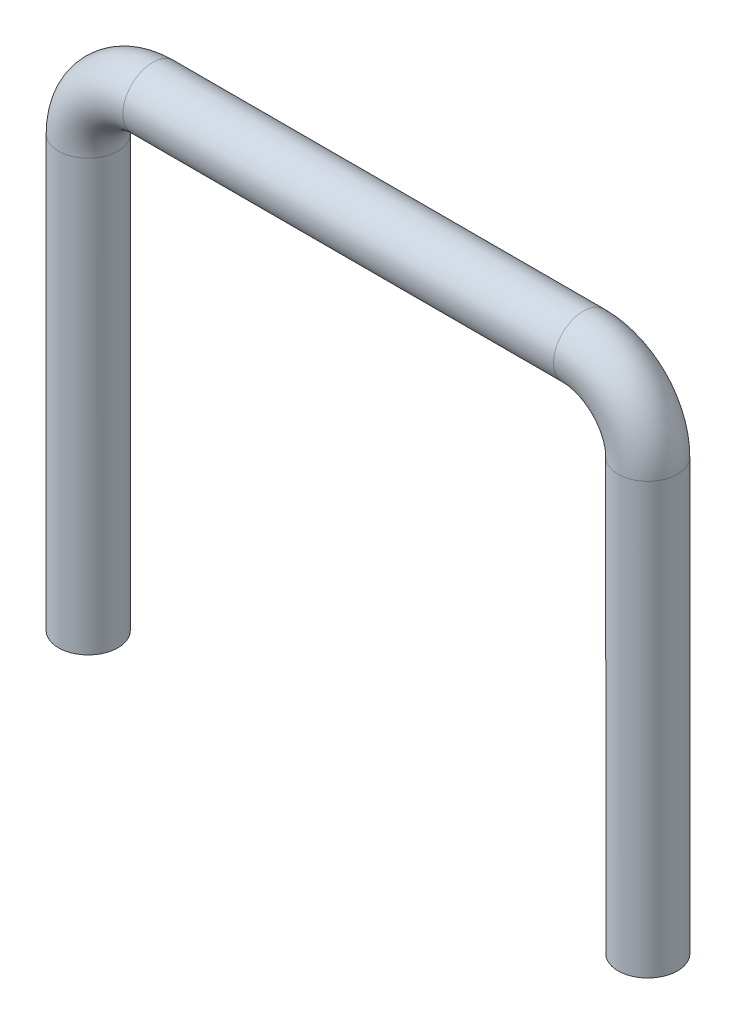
SolidWorks part; units mm, degrees
ref_plane "Plan1" through (0, 0, 0) normal (0, 0, 1) x (1, 0, 0)
ref_plane "Plan2" through (0, 0, 0) normal (0, 1, 0) x (1, 0, 0)
ref_plane "Plan3" through (0, 0, 0) normal (1, 0, 0) x (0, 0, -1)
sketch "Esquisse1" plane through (0, 0, 0) normal (0, 0, 1) x (1, 0, 0)
  line L0 (0, 0) -> (0, 434)
  line L1 (65, 499) -> (499.55, 499)
  line L2 (564.55, 434) -> (564.55, 0)
  arc A0 (499.55, 499) -> (564.55, 434) centre (499.55, 434) cw
  arc A1 (0, 434) -> (65, 499) centre (65, 434) cw
  point P7 (564.55, 499)
  point P10 (0, 499)
  dimension "D3" = 65
  dimension "D4" = 65
  dimension "D1" = 564.55
  dimension "D2" = 499
sketch "Esquisse2" plane through (0, 0, 0) normal (0, 1, 0) x (1, 0, 0)
  circle A0 centre (0, 0) radius 8
  circle A1 centre (0, 0) radius 30
  dimension "D1" = 16
  dimension "D2" = 60
sweep "Base-Balayage" add profiles "Esquisse2" path "Esquisse1"
